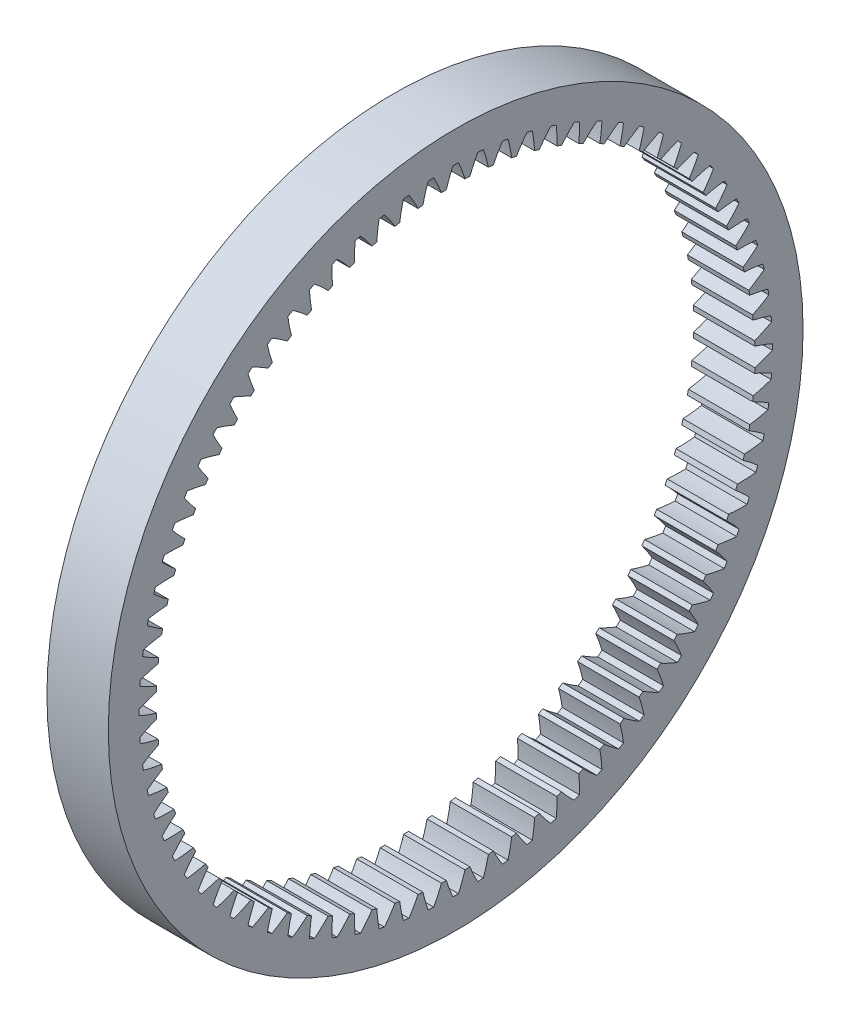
SolidWorks part; units mm, degrees
ref_plane "Plane1" through (0, 0, 0) normal (0, 0, 1) x (1, 0, 0)
ref_plane "Plane2" through (0, 0, 0) normal (0, 1, 0) x (1, 0, 0)
ref_plane "Plane3" through (0, 0, 0) normal (1, 0, 0) x (0, 0, -1)
other "Configuration Table"
sketch "HoldingSke" plane through (0, 0, 0) normal (0, 1, 0) x (1, 0, 0)
  line L0 (0, 0) -> (0.0695, -0.3939)
  line L1 (-15, 0) -> (100, 0) construction
  line L2 (0, 0) -> (-2.1039, 2.3779)
  line L3 (0, 0) -> (-11.863, 4.5341)
  line L4 (0, 0) -> (1.4996, 8.5048)
  line L5 (0, 0) -> (-23.7986, -8.8762)
  line L6 (0, 0) -> (-10.5278, -7.1032)
  line L7 (-2.1039, 2.3779) -> (3.3635, 27.1825)
  line L8 (-76.2, 4.8779) -> (-54.61, 4.8779)
  line L9 (-71.009, 38.7566) -> (-53.1078, 45.2721)
  line L10 (-76.2, 71.12) -> (104.1128, 71.12)
  line L11 (0, 0) -> (-20, 0)
  line L12 (-76.2, 101.6) -> (-76.113, 101.6)
  line L13 (24.9733, 27.94) -> (52.9518, 28.4284)
  line L14 (24.9733, 27.94) -> (24.9743, 27.94)
  line L15 (24.9733, 27.94) -> (100.4006, 29.5858)
  circle A0 centre (0, 0) radius 12.5
  circle A1 centre (0, 0) radius 12.7
  circle A2 centre (0, 0) radius 12.7
sketch "BasProSke" plane through (0, 0, 0) normal (0, 1, 0) x (1, 0, 0)
  line L0 (-10, 0) -> (60, 0) construction
  line L1 (0, 97.5) -> (0, 103.1514)
  line L2 (0, 97.5) -> (20, 97.5)
  line L3 (20, 97.5) -> (20, 103.1514)
  line L4 (20, 103.1514) -> (0, 103.1514)
revolve "Base-Revolve" add sketch "BasProSke" angle 360 about L0
sketch "TooCutSke" plane through (0, 0, 0) normal (1, 0, 0) x (0, 0, -1)
  line L3 (2.1809, 99.9762) -> (2.1809, 53.6633) construction
  line L4 (0, 0) -> (0, 59.563) construction
  line L5 (0, 0) -> (-2.6825, 68.2748) construction
  line L6 (-44.8045, 82.8772) -> (34.4933, 85.9928) construction
  circle A0 centre (0, 0) radius 100 construction
  circle A1 centre (0, 0) radius 103.126 construction
  circle A2 centre (0, 0) radius 84.5723 construction
  circle A3 centre (0, 0) radius 97.4746 construction
  arc A4 (3.0316, 97.4274) -> (0.9137, 103.122) centre (-44.8045, 82.8772) ccw
  arc A5 (3.0316, 97.4274) -> (-3.0316, 97.4274) centre (0, 0) ccw
  arc A6 (0.9137, 103.122) -> (-0.9137, 103.122) centre (0, 0) ccw
  arc A7 (-0.9137, 103.122) -> (-3.0316, 97.4274) centre (44.8045, 82.8772) ccw
extrude "ToothCut" cut sketch "TooCutSke" along normal through all
fillet "Breaks" [suppressed] radius 0.25
fillet "RootFillets" [suppressed] radius 0.626
pattern_circular "TeethCuts" count 80 every 4.5 about axis through (-10, 0, 0) along (1, 0, 0) of "RootFillets", "Breaks", "ToothCut"
sketch "Sketch1" plane through (20, 0, 0) normal (1, 0, 0) x (0, 0, -1)
  circle A0 centre (0, 0) radius 103.1514
extrude "Extrude-Thin1" add sketch "Sketch1" against normal up to surface (20 mm away) thin
scale "Scale1" scale about centroid uniform scaling yes scale factor 0.6
equation "' \"Module@HoldingSke\" = 6.35"
equation "' \"Num_teeth@HoldingSke\" = 24"
equation "' \"Ap@HoldingSke\" =  14.5"
equation "' \"Ap@HoldingSke\" = 14.5"
equation "' \"Width@HoldingSke\" = 12"
equation "' \"Diameter@HoldingSke\" = 8 * 25.4"
equation "' \"Show_teeth@HoldingSke\" = 100"
equation "' \"Backlash@HoldingSke\" = 0.009 * 25.4"
equation "' \"Addendum_fac@HoldingSke\" = 1.0"
equation "' \"Dedendum_fac@HoldingSke\" = 1.25"
equation "' \"Dedendum_add@HoldingSke\" = 0.00005 * 25.4"
equation "' \"Clearance_fac@HoldingSke\" = 0.25"
equation "\"Pitch@HoldingSke\" = 1 / \"Module@HoldingSke\" "
equation "\"Overcut_dia@TooCutSke\" = (\"Num_teeth@HoldingSke\" - 2 * \"Addendum_fac@HoldingSke\") / \"Pitch@HoldingSke\" - 0.002 * 25.4"
equation "\"Pitch_dia@TooCutSke\" = \"Num_teeth@HoldingSke\" / \"Pitch@HoldingSke\""
equation "\"Base_dia@TooCutSke\" = \"Num_teeth@HoldingSke\" / \"Pitch@HoldingSke\" * cos((\"Ap@HoldingSke\"  * 3.14159265 / 180)) * 0.90"
equation "\"Root_dia@TooCutSke\" = \"Num_teeth@HoldingSke\"  / \"Pitch@HoldingSke\" + 2 *  \"Dedendum_fac@HoldingSke\"/ \"Pitch@HoldingSke\" + \"Dedendum_add@HoldingSke\" * 2"
equation "\"Half_ang@TooCutSke\" = 180 / \"Num_teeth@HoldingSke\""
equation "\"Half_CT@TooCutSke\" = \"Num_teeth@HoldingSke\" / \"Pitch@HoldingSke\" * sin((3.14159265 / 2 / \"Num_teeth@HoldingSke\")) / 2 + 10 * \"Backlash@HoldingSke\" / 4"
equation "\"Flank_rad@TooCutSke\" = \"Num_teeth@HoldingSke\" / \"Pitch@HoldingSke\" / 4"
equation "\"Radius@RootFillets\"= \"Clearance_fac@HoldingSke\" / \"Pitch@HoldingSke\" + \"Dedendum_add@HoldingSke\""
equation "\"Break_rad@Breaks\" = 0.02 / \"Pitch@HoldingSke\" * 5"
equation "\"Num_teeth@TeethCuts\" = int( \"Show_teeth@HoldingSke\" ) + 1"
equation "\"Num_teeth@TeethCuts\" = ((sgn( \"Num_teeth@TeethCuts\" - \"Num_teeth@HoldingSke\" )-1)*( \"Num_teeth@TeethCuts\" - \"Num_teeth@HoldingSke\" ))/-2+ \"Num_teeth@HoldingSke\""
equation "\"Num_teeth@TeethCuts\" = ((sgn( \"Num_teeth@TeethCuts\" - 2.0)+1)*( \"Num_teeth@TeethCuts\" - 2.0))/2 +2.0"
equation "\"Angle@TeethCuts\" = 360.0 / \"Num_teeth@HoldingSke\""
equation "\"Diameter@BasProSke\" = \"Num_teeth@HoldingSke\"  / \"Pitch@HoldingSke\" + 2 *  \"Dedendum_fac@HoldingSke\"/ \"Pitch@HoldingSke\" + \"Dedendum_add@HoldingSke\" * 2 + 0.002 * 25.4"
equation "\"Diameter@BasProSke\" = ((sgn( \"Diameter@BasProSke\"  - \"Diameter@HoldingSke\" )+1)*( \"Diameter@BasProSke\"  - \"Diameter@HoldingSke\" ))/2 + \"Diameter@HoldingSke\""
equation "\"Inside_diameter@BasProSke\" =  (\"Num_teeth@HoldingSke\" - 2 * \"Addendum_fac@HoldingSke\") / \"Pitch@HoldingSke\" "
equation "\"Thickness@BasProSke\"  = \"Width@HoldingSke\""
